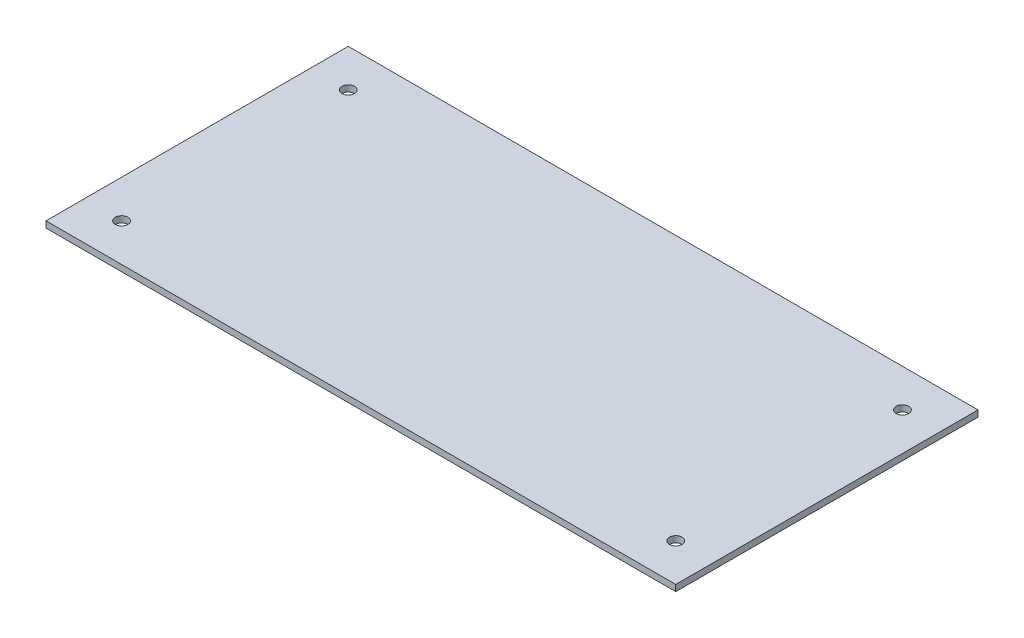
SolidWorks part; units mm, degrees
ref_plane "Front Plane" through (0, 0, 0) normal (0, 0, 1) x (1, 0, 0)
ref_plane "Top Plane" through (0, 0, 0) normal (0, 1, 0) x (1, 0, 0)
ref_plane "Right Plane" through (0, 0, 0) normal (1, 0, 0) x (0, 0, -1)
sketch "Sketch1" plane through (0, 0, 0) normal (0, 1, 0) x (1, 0, 0)
  line L0 (-1270, -609.6) -> (1270, 609.6) construction
  line L1 (-1270, 609.6) -> (1270, 609.6)
  line L2 (-1270, 609.6) -> (-1270, -609.6)
  line L3 (-1270, -609.6) -> (1270, -609.6)
  line L4 (1270, 609.6) -> (1270, -609.6)
  dimension "D1" = 2540
  dimension "D2" = 1219.2
extrude "Extrude1" add sketch "Sketch1" along normal blind 25.4
sketch "Sketch2" plane through (0, 25.4, 0) normal (0, 1, 0) x (1, 0, 0)
  line L0 (1270, 609.6) -> (-1270, 609.6) construction
  line L1 (-1270, 609.6) -> (-1270, -609.6) construction
  circle A0 centre (-1117.6, 457.2) radius 25.4
  dimension "D1" = 152.4
  dimension "D2" = 152.4
  dimension "D3" = 50.8
extrude "Cut-Extrude1" cut sketch "Sketch2" against normal through all
mirror "Mirror1" about plane through (0, 0, 0) normal (0, 0, 1) of "Cut-Extrude1"
mirror "Mirror2" about plane through (0, 0, 0) normal (1, 0, 0) of "Mirror1", "Cut-Extrude1"
